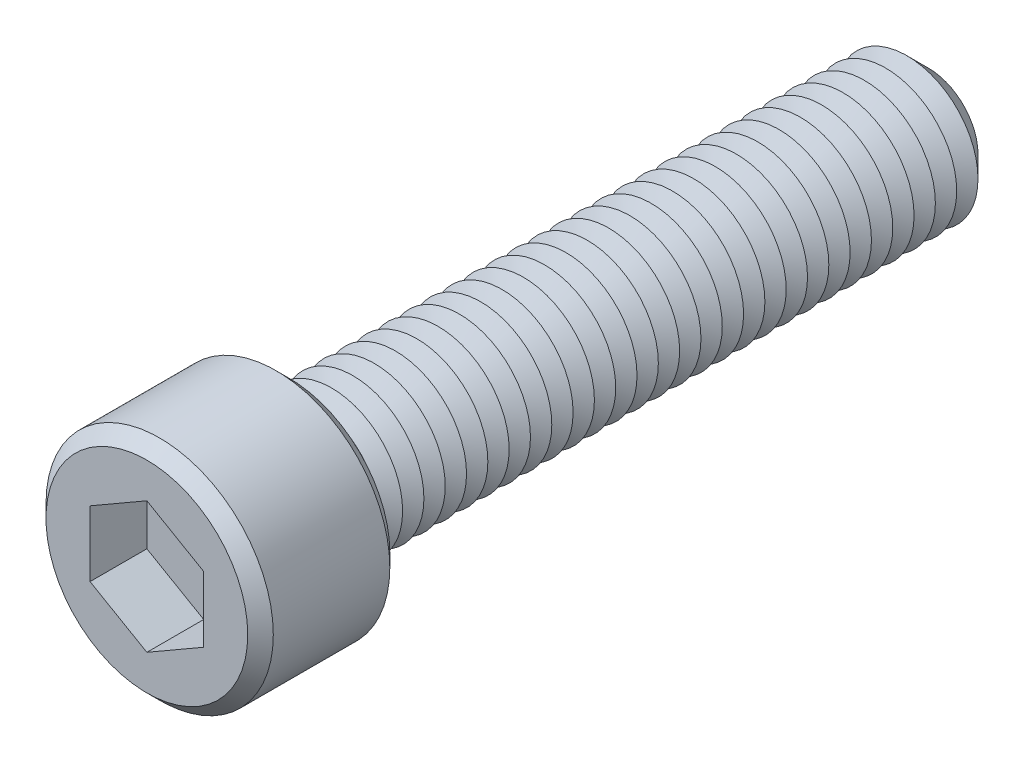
SolidWorks part; units mm, degrees
ref_plane "Front Plane" through (0, 0, 0) normal (0, 0, 1) x (1, 0, 0)
ref_plane "Top Plane" through (0, 0, 0) normal (0, 1, 0) x (1, 0, 0)
ref_plane "Right Plane" through (0, 0, 0) normal (1, 0, 0) x (0, 0, -1)
sketch "Sketch1" plane through (0, 0, 0) normal (0, 0, 1) x (1, 0, 0)
  circle A0 centre (0, 0) radius 8
  dimension "D1" = 16
extrude "Boss-Extrude1" add sketch "Sketch1" along normal blind 10
sketch "Sketch2" plane through (0, 0, 0) normal (0, 0, -1) x (-1, 0, 0)
  circle A0 centre (0, 0) radius 5
  dimension "D1" = 10
extrude "Boss-Extrude2" add sketch "Sketch2" along normal blind 45
chamfer "Chamfer1" distance 1.5 angle 45 1 edges at (-5, 0, -45)
sketch "Sketch3" plane through (0, 0, 0) normal (1, 0, 0) x (0, 0, -1)
  line L0 (-2.5121, 0) -> (4.5776, 0) construction
sketch "Sketch4" plane through (0, 0, 0) normal (1, 0, 0) x (0, 0, -1)
  line L0 (0, 5) -> (0.75, 3.701)
  line L1 (0.75, 3.701) -> (1.5, 5)
  line L2 (43.5, 5) -> (0, 5) construction
  line L3 (1.5, 5) -> (0, 5)
  dimension "D1" = 1.5
revolve "Cut-Revolve1" cut sketch "Sketch4" angle 360 about L0
pattern_linear "LPattern1" count 29 spacing 1.5 along (0, 0, -1) of "Cut-Revolve1"
sketch "Sketch5" plane through (0, 0, 10) normal (0, 0, 1) x (1, 0, 0)
  line L1 (0, 4.6188) -> (-4, 2.3094)
  line L2 (-4, 2.3094) -> (-4, -2.3094)
  line L3 (-4, -2.3094) -> (0, -4.6188)
  line L4 (0, -4.6188) -> (4, -2.3094)
  line L5 (4, -2.3094) -> (4, 2.3094)
  line L6 (4, 2.3094) -> (0, 4.6188)
  circle A0 centre (0, 0) radius 4 construction
  dimension "D1" = 8
extrude "Cut-Extrude1" cut sketch "Sketch5" against normal blind 4
sketch "Sketch6" plane through (0, 0, 6) normal (0, 0, 1) x (1, 0, 0)
  circle A0 centre (0, 0) radius 0.9
  dimension "D1" = 1.8
extrude "Cut-Extrude2" cut sketch "Sketch6" against normal up to surface (51 mm away)
chamfer "Chamfer2" distance 0.9 angle 45 2 edges at (8, 0, 0) (8, 0, 10)
